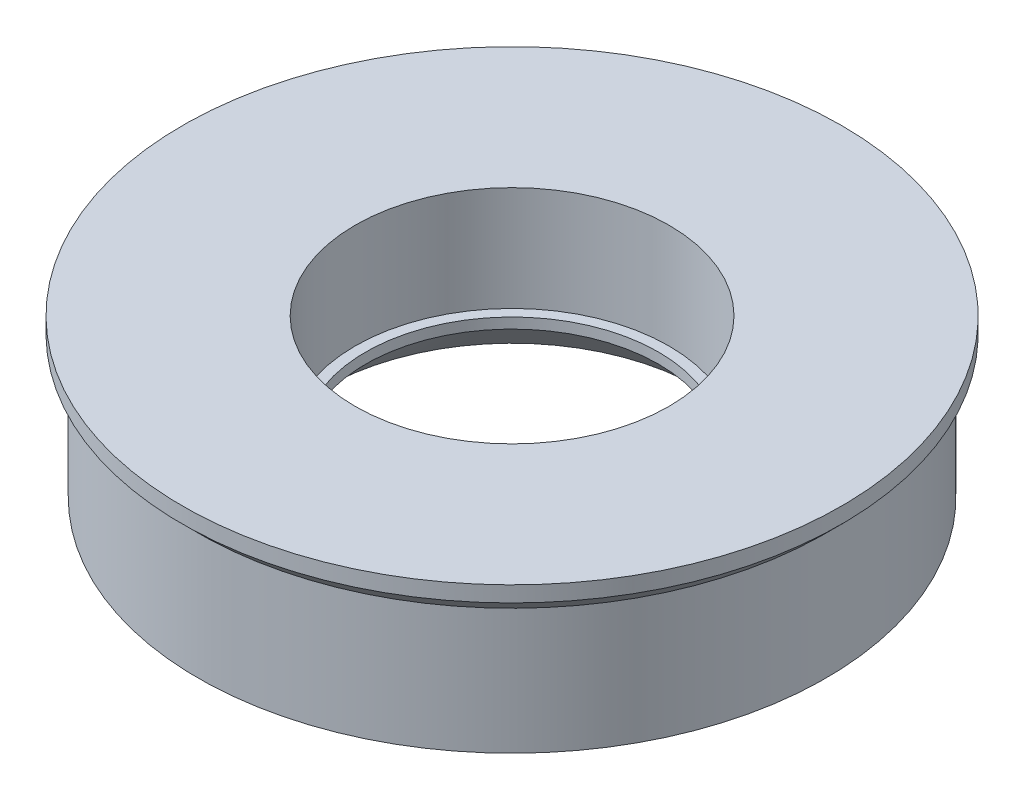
SolidWorks part; units mm, degrees
ref_plane "Face" through (0, 0, 0) normal (0, 0, 1) x (1, 0, 0)
ref_plane "Dessus" through (0, 0, 0) normal (0, 1, 0) x (1, 0, 0)
ref_plane "Droite" through (0, 0, 0) normal (1, 0, 0) x (0, 0, -1)
sketch "Esquisse1" plane through (0, 0, 0) normal (0, 0, 1) x (1, 0, 0)
  line L0 (0, 0) -> (0, 55.0676) construction
  line L1 (15, 15) -> (15, 5)
  line L2 (15, 5) -> (14, 5)
  line L3 (14, 5) -> (14, 0)
  line L4 (14, 0) -> (30, 0)
  line L5 (30, 0) -> (30, 12)
  line L6 (30, 12) -> (31.5, 12)
  line L7 (31.5, 12) -> (31.5, 15)
  line L8 (31.5, 15) -> (15, 15)
  dimension "D1" = 28
  dimension "D2" = 30
  dimension "D3" = 60
  dimension "D4" = 63
  dimension "D5" = 5
  dimension "D6" = 3
  dimension "D7" = 12
revolve "Révolution1" add sketch "Esquisse1" angle 360 about L0
chamfer "Chanfrein1" distance 4 angle 45 1 edges at (0, 0, -14)
chamfer "Chanfrein2" distance 1.5 angle 45 1 edges at (0, 12, -31.5)
